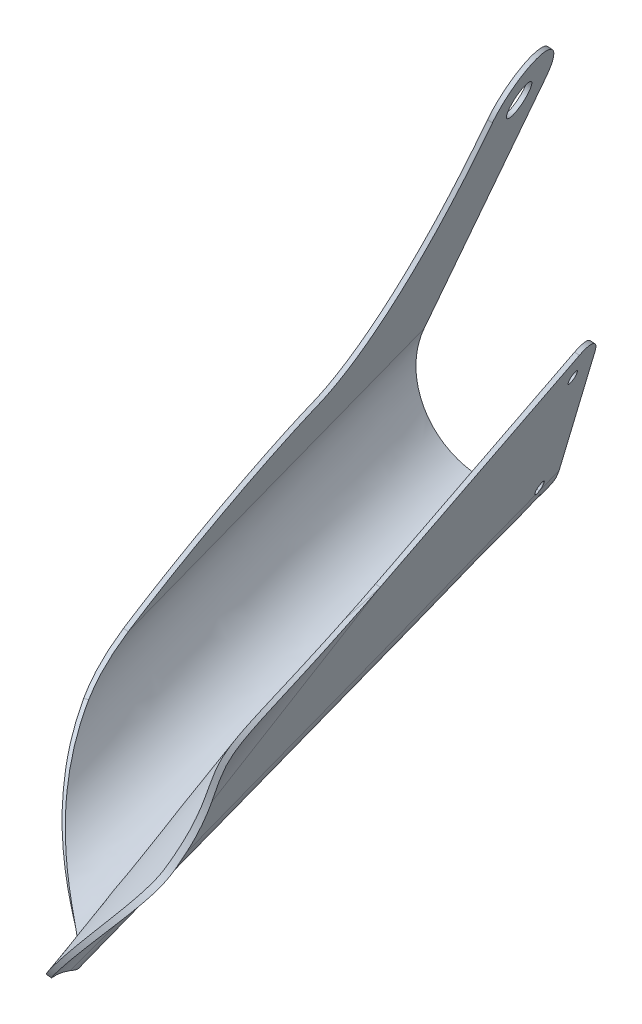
SolidWorks part; units mm, degrees
ref_plane "Plan de face" through (0, 0, 0) normal (0, 0, 1) x (1, 0, 0)
ref_plane "Plan de dessus" through (0, 0, 0) normal (0, 1, 0) x (1, 0, 0)
ref_plane "Plan de droite" through (0, 0, 0) normal (1, 0, 0) x (0, 0, -1)
sketch "Esquisse1" plane through (0, 0, 0) normal (0, 1, 0) x (1, 0, 0)
  line L0 (-140.6083, 0) -> (17.4428, 0) construction
  line L1 (-120, 15.4464) -> (-120, -20.9104) construction
  line L2 (0, 21.1355) -> (0, -170.8713) construction
  line L3 (-23.913, -125) -> (54.5761, -125) construction
  line L4 (23, -65.1594) -> (23, -134.5121) construction
  line L5 (18.8615, -117) -> (47.5162, -117) construction
  line L6 (-75, -51.0397) -> (-75, 48.4213) construction
  line L7 (-80.8071, -33) -> (-33.4645, -33) construction
  line L8 (-135, 24.127) -> (-135, -3.4895) construction
  line L9 (-135, 0) -> (0, -125) construction
  line L10 (-50, -53.3238) -> (-50, -86.1313) construction
  line L11 (-10.0009, -50) -> (58.9366, -50) construction
  line L12 (-5, 0) -> (-112.5, 0)
  line L14 (0, -5) -> (0, -50)
  line L15 (-117.5, -15) -> (-69.3834, -15) construction
  line L16 (-112.5, -7.5) -> (-112.5, 21.1355) construction
  line L17 (-50, -78.7037) -> (0, -125)
  circle A0 centre (-112.5, -7.5) radius 2.75
  circle A1 centre (-112.5, -7.5) radius 7.5 construction
  arc A2 (-112.5, 0) -> (-112.5, -15) centre (-112.5, -7.5) ccw
  arc A3 (-5, 0) -> (0, -5) centre (-5, -5) cw
  circle A4 centre (-5, -5) radius 1
  circle A5 centre (-30, -5) radius 1
  spline S0 degree 3 poles (-112.5, -15) (-86.7603, -14.8544) (-76.9117, -24.5638) (-72.6058, -43.5653) (-63.3492, -66.3039) (-50, -78.7037) knots 0 0 0 0 0.443974 0.443974 1 1 1 1
  spline S1 degree 3 poles (0, -50) (0.1512, -94.0799) (23.0531, -94.6311) (22.9818, -124.6896) (6.9681, -131.524) (0, -125) knots 0 0 0 0 0.744178 0.744178 1 1 1 1
  point P42 (0, 0)
  dimension "D1" = 5
extrude "Extrusion1" add sketch "Esquisse1" against normal blind 0.7366
other "Flexion3" parameters "D0"=180, "D1"=49.5, "D2"=31.2622
other "Flexion6" parameters "D0"=54.623, "D1"=26.187
sketch "Esquisse3" plane through (-64.1209, 22.9984, 17.3158) normal (-0.9123, 0.3272, 0.2464) x (0.2319, -0.0832, 0.9692)
  text T0 "www.a4.fr" font "Arial" height 0.001
extrude "Enlèv. mat.-Extru.3" cut sketch "Esquisse3" against normal blind 0.1
sketch "Esquisse4" plane through (-40.4318, 14.5018, 10.9186) normal (0.9123, -0.3272, -0.2464) x (-0.2319, 0.0832, -0.9692)
  text T0 "www.a4.fr" font "Arial" height 0.01
extrude "Enlèv. mat.-Extru.4" cut sketch "Esquisse4" against normal blind 0.01
